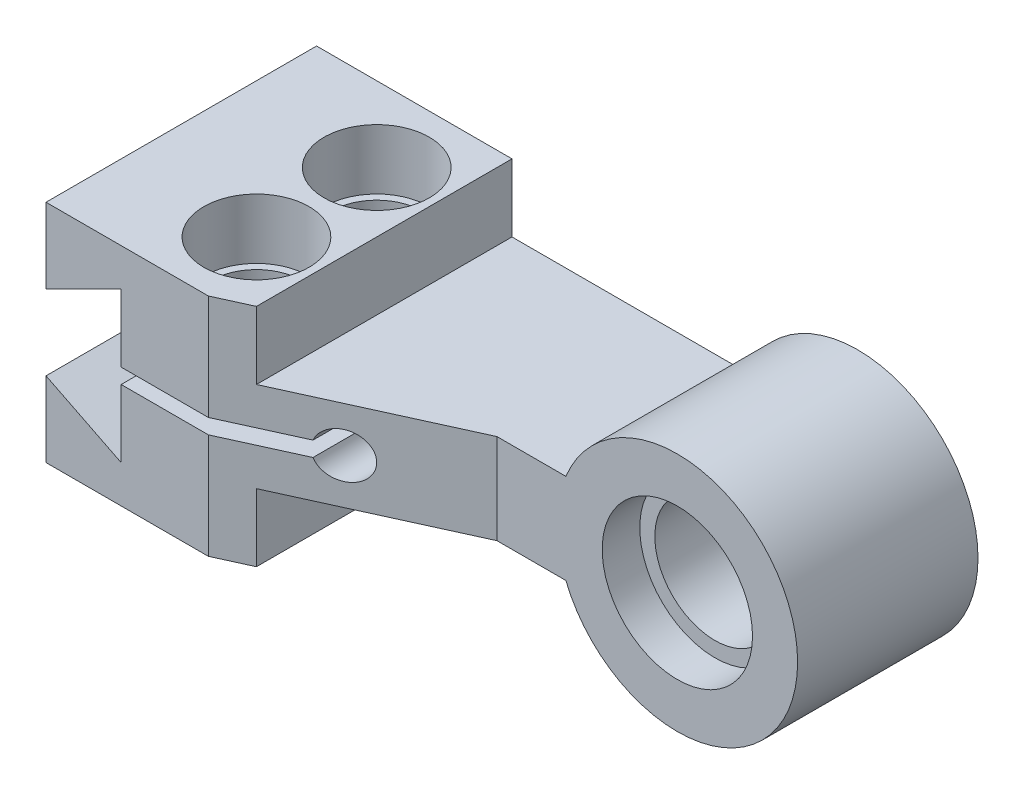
SolidWorks part; units mm, degrees
ref_plane "前视基准面" through (0, 0, 0) normal (0, 0, 1) x (1, 0, 0)
ref_plane "上视基准面" through (0, 0, 0) normal (0, 1, 0) x (1, 0, 0)
ref_plane "右视基准面" through (0, 0, 0) normal (1, 0, 0) x (0, 0, -1)
sketch "草图1" plane through (0, 0, 0) normal (0, 0, 1) x (1, 0, 0)
  circle A0 centre (0, 0) radius 8
  circle A1 centre (0, 0) radius 4
extrude "拉伸1" add sketch "草图1" along normal blind 12
sketch "草图2" plane through (0, 0, 0) normal (0, 1, 0) x (1, 0, 0)
  line L1 (-23, 0) -> (-23, -17)
  line L2 (-23, -17) -> (-12, -12)
  line L3 (-23, 0) -> (-5.3039, 0)
  line L5 (8, 0) -> (-8, 0) construction
  line L6 (-5.3039, 0) -> (-5.3039, -12)
  line L7 (-8, -12) -> (8, -12) construction
  line L8 (-5.3039, -12) -> (-12, -12)
extrude "拉伸2" add sketch "草图2" along normal mid plane 6
sketch "草图3" plane through (0, 0, 0) normal (0, 1, 0) x (1, 0, 0)
  line L0 (-23, 0) -> (-36, 0)
  line L1 (-36, 0) -> (-36, -18)
  line L2 (-25.2, -18) -> (-23, -17)
  line L3 (-23, -17) -> (-12, -12) construction
  line L5 (-36, -18) -> (-25.2, -18)
  line L6 (-23, 0) -> (-23, -17)
extrude "拉伸3" add sketch "草图3" along normal mid plane 15
sketch "草图5" plane through (0, 0, 0) normal (0, 0, 1) x (1, 0, 0)
  line L0 (0, 0) -> (-37.2554, 0) construction
  line L1 (-19, 12.7293) -> (-19, -12.0998) construction
  line L2 (-36, 7.5) -> (-36, -7.5) construction
  line L3 (-20.4142, 0.5) -> (-31, 0.5)
  line L4 (-31, 0.5) -> (-31, 5)
  line L5 (-31, 5) -> (-36, 2.5)
  line L6 (-36, 7.5) -> (-25.2, 7.5) construction
  line L7 (-20.4142, -0.5) -> (-31, -0.5)
  line L8 (-31, -5) -> (-36, -2.5)
  line L9 (-31, -0.5) -> (-31, -5)
  line L10 (-36, -2.5) -> (-36, 2.5)
  arc A0 (-20.4142, -0.5) -> (-20.4142, 0.5) centre (-19, 0) ccw
  dimension "D2" = 5
  dimension "D1" = 17
  dimension "D3" = 5
  dimension "D4" = 4.5
extrude "切除-拉伸1" cut sketch "草图5" along normal through all
sketch "草图9" plane through (0, 7.5, 0) normal (0, 1, 0) x (1, 0, 0)
  line L0 (-37.815, -9) -> (-17.602, -9) construction
  line L1 (-36, -18) -> (-25.2, -18) construction
  line L2 (-23, 0) -> (-36, 0) construction
  line L3 (-36, 0) -> (-36, -18) construction
  circle A0 centre (-27, -13) radius 3
  circle A1 centre (-27, -5) radius 3
  dimension "D1" = 9
  dimension "D2" = 4
extrude "切除-拉伸16" cut sketch "草图9" against normal up to next
sketch "草图10" plane through (0, 7.5, 0) normal (0, 1, 0) x (1, 0, 0)
  circle A0 centre (-27, -5) radius 3.5
  circle A1 centre (-27, -13) radius 3.5
extrude "切除-拉伸17" cut sketch "草图10" against normal blind 4
hole_wizard "M5 螺纹孔3" positions "3D草图3" profile "草图14" tap size "M5" standard "ISO"
sketch3d "3D草图3"
  line L0 (-36, -7.5, 9) -> (-13.2656, -7.5, 9) construction
  line L1 (-36, -7.5, 0) -> (-36, -7.5, 18) construction
  point P0 (-27, -7.5, 13)
  point P2 (-27, -7.5, 5)
  dimension "D1" = 4
  dimension "D2" = 4
  dimension "D3" = 9
  dimension "D4" = 9
sketch "草图14" plane through (-27, -7.5, 13) normal (1, 0, 0) x (0, 0, -1)
  line L0 (0, 0) -> (0, 7)
  line L1 (0, 7) -> (2.5, 7)
  line L2 (2.5, 7) -> (2.5, 0)
  line L5 (2.5, 0) -> (0, 0)
  line L11 (0, -6.35) -> (0, 107.95) construction
  dimension "蹟恇盄翋眻噤" = 5
  dimension "籵謂蹟恇謂郰芛旮僅" = 7
sketch "草图15" plane through (0, 0, 12) normal (0, 0, 1) x (1, 0, 0)
  circle A0 centre (0, 0) radius 5
extrude "切除-拉伸18" cut sketch "草图15" against normal blind 2.5
